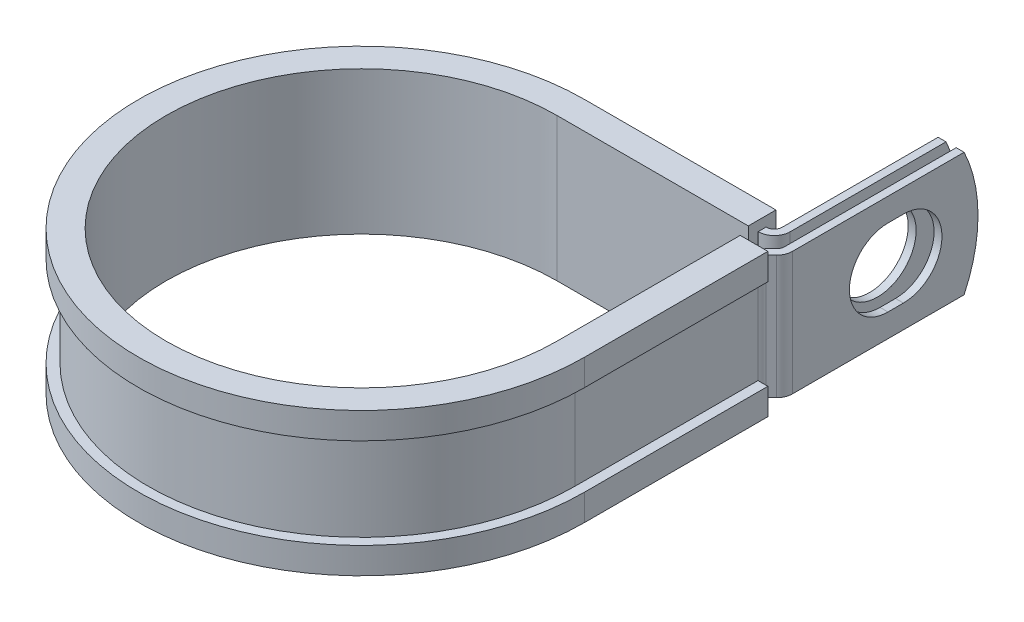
SolidWorks part; units mm, degrees
ref_plane "Front Plane" through (0, 0, 0) normal (0, 0, 1) x (1, 0, 0)
ref_plane "Top Plane" through (0, 0, 0) normal (0, 1, 0) x (1, 0, 0)
ref_plane "Right Plane" through (0, 0, 0) normal (1, 0, 0) x (0, 0, -1)
sketch "Sketch1" plane through (0, 0, 0) normal (0, 1, 0) x (1, 0, 0)
  line L0 (0, 31.6865) -> (29.5708, 31.6865)
  line L1 (31.6865, 0) -> (31.6865, 28.274)
  line L2 (32.0092, 60.325) -> (32.0092, 34.1249)
  line L3 (32.4007, 29.9982) -> (33.2269, 30.8244)
  line L5 (33.584, 31.6865) -> (33.584, 60.325)
  arc A0 (0, 31.6865) -> (31.6865, 0) centre (0, 0) ccw
  arc A1 (32.4007, 29.9982) -> (31.6865, 28.274) centre (34.1249, 28.274) ccw
  arc A2 (33.2269, 30.8244) -> (33.584, 31.6865) centre (32.3648, 31.6865) ccw
  arc A3 (29.5708, 31.6865) -> (32.0092, 34.1249) centre (29.5708, 34.1249) ccw
extrude "Extrude-Thin1" add sketch "Sketch1" along normal mid plane 19.05 thin
sketch "Sketch2" plane through (30.79, 0, 0) normal (-1, 0, 0) x (0, 0, 1)
  line L0 (-60.325, 9.525) -> (-60.325, -9.525) construction
  line L1 (0, 9.525) -> (0, -9.525) construction
  circle A0 centre (-47.625, 0) radius 5.9436
  point P2 (-60.325, 0)
extrude "Cut-Extrude1" cut sketch "Sketch2" against normal up to surface (1.2192 mm away)
sketch "Sketch3" plane through (34.8032, 0, 0) normal (1, 0, 0) x (0, 0, -1)
  line L0 (46.4312, 0) -> (48.8188, 0) construction
  line L1 (46.4312, 5.9436) -> (48.8188, 5.9436)
  line L2 (46.4312, -5.9436) -> (48.8188, -5.9436)
  line L3 (60.325, 9.525) -> (60.325, -9.525) construction
  arc A0 (46.4312, 5.9436) -> (46.4312, -5.9436) centre (46.4312, 0) ccw
  arc A1 (48.8188, -5.9436) -> (48.8188, 5.9436) centre (48.8188, 0) ccw
  point P3 (47.625, 0)
  point P8 (60.325, 0)
  point P11 (40.4876, 0)
  point P12 (54.7624, 0)
extrude "Cut-Extrude2" cut sketch "Sketch3" against normal up to surface (1.2192 mm away)
sketch "Sketch4" plane through (30.79, 0, 0) normal (-1, 0, 0) x (0, 0, 1)
  line L0 (-60.325, 9.525) -> (-60.325, -9.525)
  line L1 (-60.325, 9.525) -> (-58.1805, 9.525)
  line L2 (-60.325, 9.525) -> (-34.1249, 9.525) construction
  line L3 (-60.325, -9.525) -> (-58.1805, -9.525)
  line L4 (-60.325, -9.525) -> (-34.1249, -9.525) construction
  arc A0 (-58.1805, 9.525) -> (-58.1805, -9.525) centre (-38.1, 0) ccw
extrude "Cut-Extrude3" cut sketch "Sketch4" against normal through all contours A0 M4 M5 | A0 L0 M2
ref_plane "Plane1" through (0, 0, -28.274) normal (0, 0, -1) x (-1, 0, 0)
ref_plane "Plane2" through (29.52, 0, 0) normal (-1, 0, 0) x (0, 0, 1)
sketch "Sketch5" plane through (0, 0, -28.274) normal (0, 0, -1) x (-1, 0, 0)
  line L0 (-32.9057, 9.525) -> (-31.6865, 9.525)
  line L1 (-32.9057, 9.525) -> (-32.9057, -9.525) construction
  line L3 (-31.6865, 9.525) -> (-31.6865, -9.525)
  line L4 (-31.6865, -9.525) -> (-32.9057, -9.525)
  line L5 (-32.9057, -9.525) -> (-32.9057, -6.985)
  line L6 (-32.9057, 9.525) -> (-32.9057, 6.985)
  line L7 (-34.4297, 11.049) -> (-34.4297, 6.985)
  line L8 (-34.4297, 11.049) -> (-30.1625, 11.049)
  line L9 (-30.1625, 11.049) -> (-30.1625, -11.049)
  line L10 (-30.1625, -11.049) -> (-34.4297, -11.049)
  line L11 (-34.4297, -11.049) -> (-34.4297, -6.985)
  line L12 (-34.4297, 6.985) -> (-32.9057, 6.985)
  line L13 (-32.9057, -6.985) -> (-34.4297, -6.985)
sketch "Sketch6" plane through (0, 9.525, 0) normal (0, 1, 0) x (1, 0, 0)
  line L0 (30.1625, 0) -> (30.1625, 28.274)
  line L1 (30.1625, 28.274) -> (34.4297, 28.274) construction
  line L2 (29.52, 6.9878) -> (29.52, -6.9878) construction
  line L5 (0, 30.1625) -> (29.52, 30.1625)
  arc A0 (0, 30.1625) -> (30.1625, 0) centre (0, 0) ccw
sweep "Sweep1" add profiles "Sketch5" path "Sketch6"
equation "\"D4@Sketch5\" = \"D1@Extrude-Thin1\""
equation "\"D5@Sketch5\" = \"D5@Extrude-Thin1\""
equation "\"D1@Sketch3\" = \"D2@Sketch2\""
equation "\"D7@Sketch1\" = \"D3@Sketch2\" + \"D1@Sketch3\""
equation "\"D1@Sketch1\" = \"D1@Sketch6\" + 2 * \"D3@Sketch5\""
equation "\"D1@Sketch4\" = ( \"D1@Extrude-Thin1\" + .125 ) * 2"
equation "\"D9@Sketch1\"= \"D5@Extrude-Thin1\""
equation "\"D8@Sketch1\"= 2 * \"D5@Extrude-Thin1\""
equation "\"D2@Sketch1\" = 2 * \"D5@Extrude-Thin1\""
equation "\"D2@Sketch3\" = \"D1@Sketch2\""
